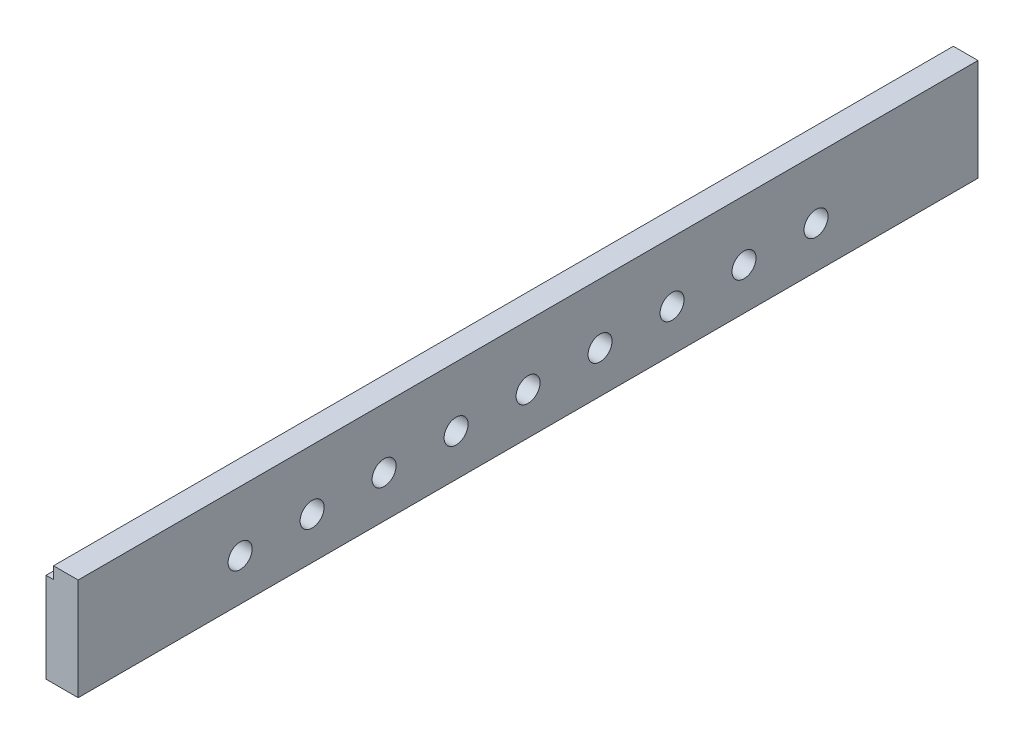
SolidWorks part; units mm, degrees
ref_plane "Přední rovina" through (0, 0, 0) normal (0, 0, 1) x (1, 0, 0)
ref_plane "Horní rovina" through (0, 0, 0) normal (0, 1, 0) x (1, 0, 0)
ref_plane "Pravá rovina" through (0, 0, 0) normal (1, 0, 0) x (0, 0, -1)
sketch "Skica1" plane through (0, 0, 0) normal (0, 0, 1) x (1, 0, 0)
  line L0 (0, 0) -> (0, 15)
  line L1 (0, 15) -> (1.25, 15)
  line L2 (1.25, 15) -> (1.25, 17)
  line L3 (1.25, 17) -> (5.36, 17)
  line L4 (5.36, 17) -> (5.36, 0)
  line L5 (5.36, 0) -> (0, 0)
  dimension "D1" = 5.36
  dimension "D2" = 17
  dimension "D3" = 15
  dimension "D4" = 1.25
extrude "Vysunout1" add sketch "Skica1" against normal blind 150
sketch "Skica2" plane through (0, 0, 0) normal (-1, 0, 0) x (0, 0, 1)
  line L0 (-150, 0) -> (0, 0) construction
  line L1 (-75, 0) -> (-75, 17) construction
  line L2 (-150, 17) -> (0, 17) construction
  circle A0 centre (-123, 7) radius 2
  dimension "D3" = 4
  dimension "D1" = 7
  dimension "D2" = 48
extrude "Odebrat vysunutím1" cut sketch "Skica2" against normal through all
pattern_linear "LinPole1" count 9 spacing 12 along (0, 0, 1) of "Odebrat vysunutím1"
